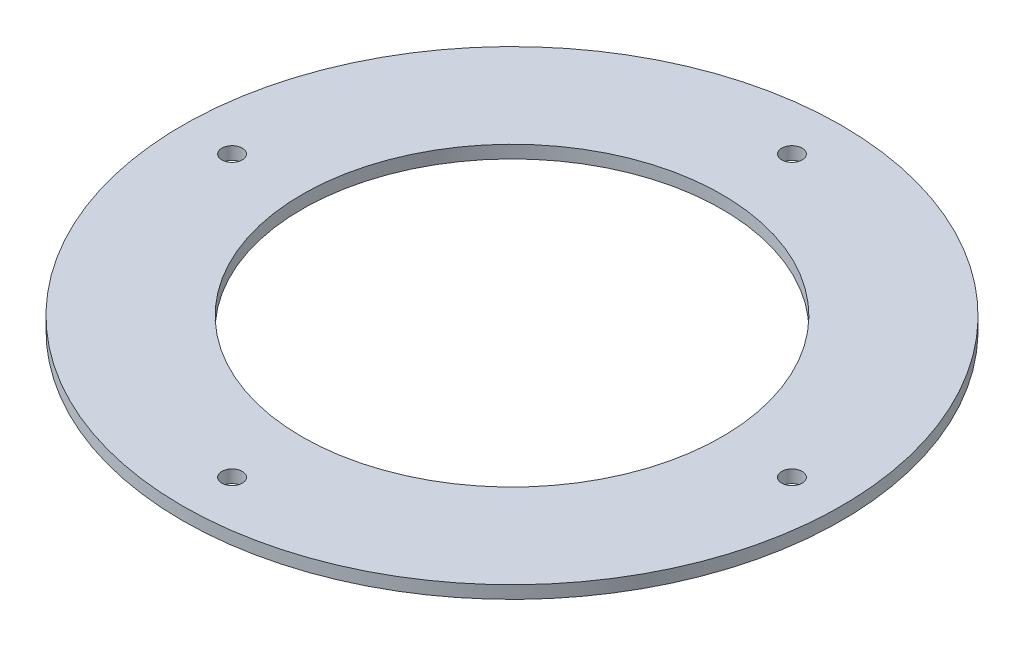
SolidWorks part; units mm, degrees
ref_plane "Front Plane" through (0, 0, 0) normal (0, 0, 1) x (1, 0, 0)
ref_plane "Top Plane" through (0, 0, 0) normal (0, 1, 0) x (1, 0, 0)
ref_plane "Right Plane" through (0, 0, 0) normal (1, 0, 0) x (0, 0, -1)
sketch "Sketch1" plane through (0, 0, 0) normal (0, 1, 0) x (1, 0, 0)
  line L0 (0, 69.85) -> (0, 0) construction
  line L1 (69.85, 0) -> (0, 0) construction
  line L2 (0, -69.85) -> (0, 0) construction
  line L3 (-69.85, 0) -> (0, 0) construction
  circle A0 centre (0, 0) radius 82.2325
  circle A1 centre (0, 0) radius 52.3875
  point P11 (0, 0)
  dimension "D1" = 104.775
  dimension "D2" = 164.465
  dimension "D4" = 4
  dimension "D3" = 69.85
extrude "Boss-Extrude1" add sketch "Sketch1" along normal blind 3.175 contours A1
hole_wizard "#10 Clearance Hole1" positions "Sketch2" profile "Sketch3" hole size "#10" standard "ANSI Inch"
sketch "Sketch2" plane through (0, 3.175, 0) normal (0, 1, 0) x (1, 0, 0)
  point P0 (0, 69.85)
  point P4 (69.85, 0)
  point P7 (0, -69.85)
  point P10 (-69.85, 0)
sketch "Sketch3" plane through (0, 3.175, -69.85) normal (1, 0, 0) x (0, 0, 1)
  line L0 (0, 0) -> (0, 3.175)
  line L1 (0, 3.175) -> (2.5527, 3.175)
  line L2 (2.5527, 3.175) -> (2.5527, 0)
  line L5 (2.5527, 0) -> (0, 0)
  line L11 (0, -6.35) -> (0, 107.95) construction
  dimension "Thru Hole Dia." = 5.1054
  dimension "Thru Hole Depth" = 3.175
